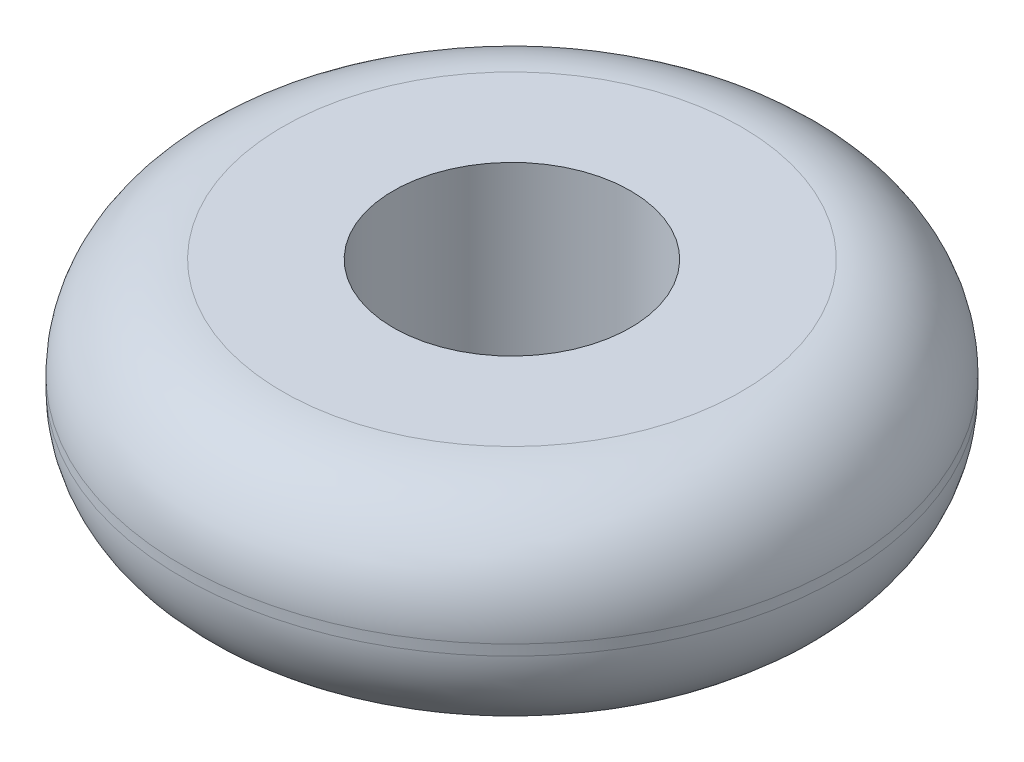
SolidWorks part; units mm, degrees
ref_plane "Plan de face" through (0, 0, 0) normal (0, 0, 1) x (1, 0, 0)
ref_plane "Plan de dessus" through (0, 0, 0) normal (0, 1, 0) x (1, 0, 0)
ref_plane "Plan de droite" through (0, 0, 0) normal (1, 0, 0) x (0, 0, -1)
sketch "Esquisse1" plane through (0, 0, 0) normal (0, 0, 1) x (1, 0, 0)
  line L0 (0, 0) -> (0, 37.4699) construction
  line L1 (-12.5, 3.8) -> (-12.5, 4.2)
  line L2 (-8.7, 8) -> (-4.5, 8)
  line L3 (-4.5, 8) -> (-4.5, 0)
  line L4 (-4.5, 0) -> (-8.7, 0)
  line L5 (-12.5, 4) -> (0, 4) construction
  arc A4 (-8.7, 8) -> (-12.5, 4.2) centre (-8.7, 4.2) ccw
  arc A5 (-12.5, 3.8) -> (-8.7, 0) centre (-8.7, 3.8) ccw
  point P11 (-4.5, 8)
  point P16 (-12.5, 0)
  point P19 (-12.5, 8)
  dimension "D4" = 3.8
  dimension "D1" = 25
  dimension "D2" = 8
  dimension "D3" = 8
revolve "Révolution1" add sketch "Esquisse1" angle 360 about L0
ref_plane "Plan1" through (0, 4, 0) normal (0, 1, 0) x (1, 0, 0)
